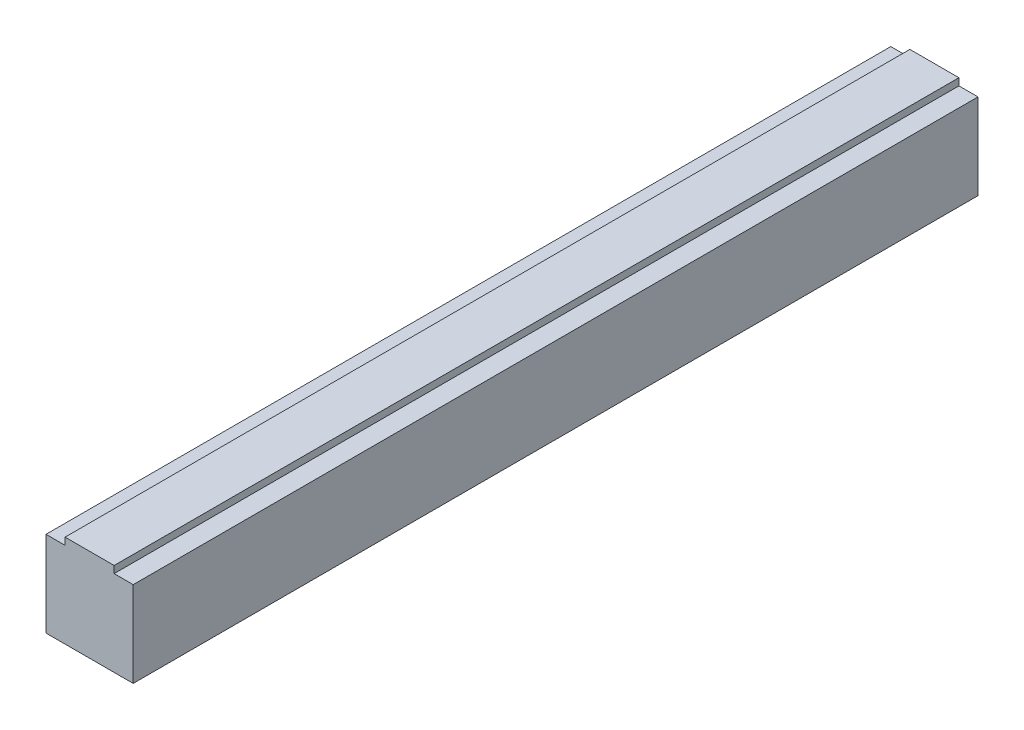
SolidWorks part; units mm, degrees
ref_plane "Płaszczyzna przednia" through (0, 0, 0) normal (0, 0, 1) x (1, 0, 0)
ref_plane "Płaszczyzna górna" through (0, 0, 0) normal (0, 1, 0) x (1, 0, 0)
ref_plane "Płaszczyzna prawa" through (0, 0, 0) normal (1, 0, 0) x (0, 0, -1)
sketch "Szkic2" plane through (0, 0, 0) normal (0, 0, 1) x (1, 0, 0)
  line L0 (4.5, 29.7607) -> (4.5, 28.4607)
  line L1 (-4.5, 29.7607) -> (4.5, 29.7607)
  line L2 (-8, 28.4607) -> (-8, 12.7607)
  line L3 (-8, 12.7607) -> (8, 12.7607)
  line L4 (8, 28.4607) -> (8, 12.7607)
  line L5 (-6.7765, 28.4607) -> (8, 12.7607) construction
  line L6 (-8, 12.7607) -> (6.7765, 28.4607) construction
  line L7 (4.5, 28.4607) -> (8, 28.4607)
  line L8 (0, 31.2078) -> (0, 10.088) construction
  line L9 (-4.5, 28.4607) -> (-8, 28.4607)
  line L10 (-4.5, 29.7607) -> (-4.5, 28.4607)
  point P0 (0, 21.2607)
  dimension "D3" = 1.3
  dimension "D4" = 3.5
extrude "Dodanie-wyciągnięcie2" add sketch "Szkic2" against normal blind 155 from offset 5 separate body
